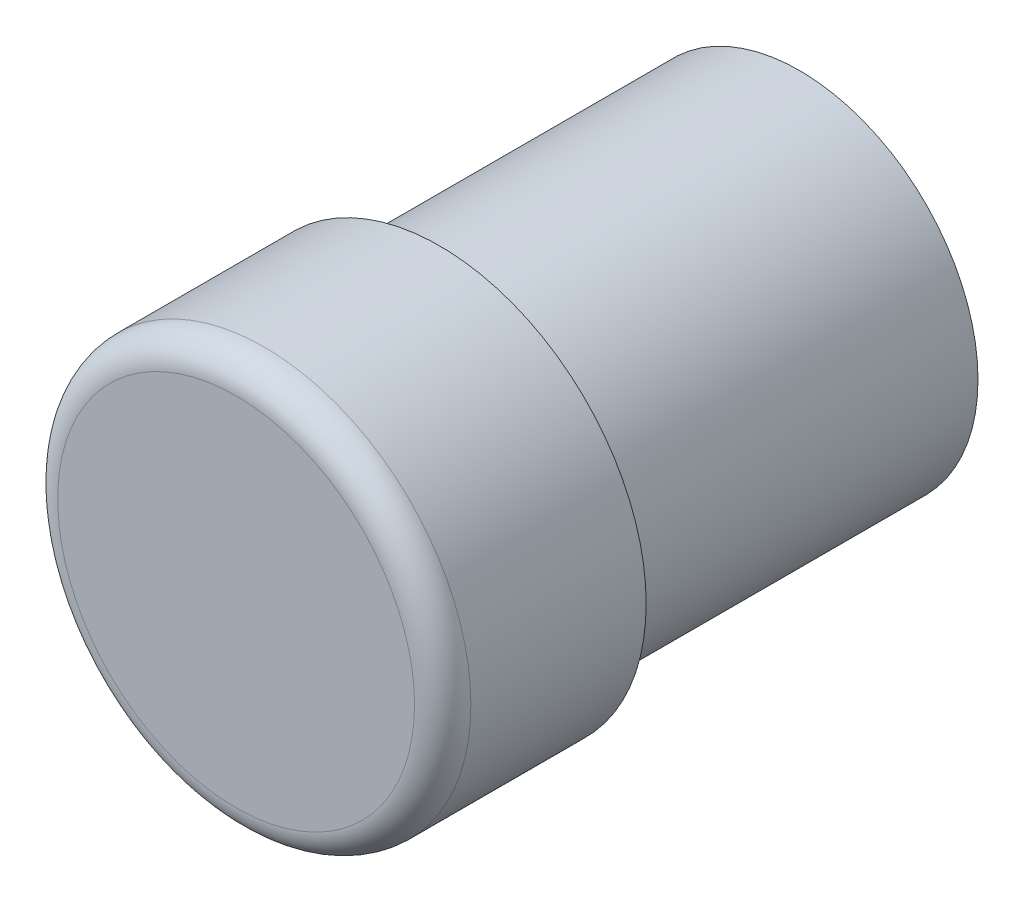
SolidWorks part; units mm, degrees
other "<Key  Socket>-<Revolve1>"
ref_plane "Front Plane" through (0, 0, 0) normal (0, 0, 1) x (1, 0, 0)
ref_plane "Top Plane" through (0, 0, 0) normal (0, 1, 0) x (1, 0, 0)
ref_plane "Right Plane" through (0, 0, 0) normal (1, 0, 0) x (0, 0, -1)
mirrored part "Key  Socket_Mirrored"
